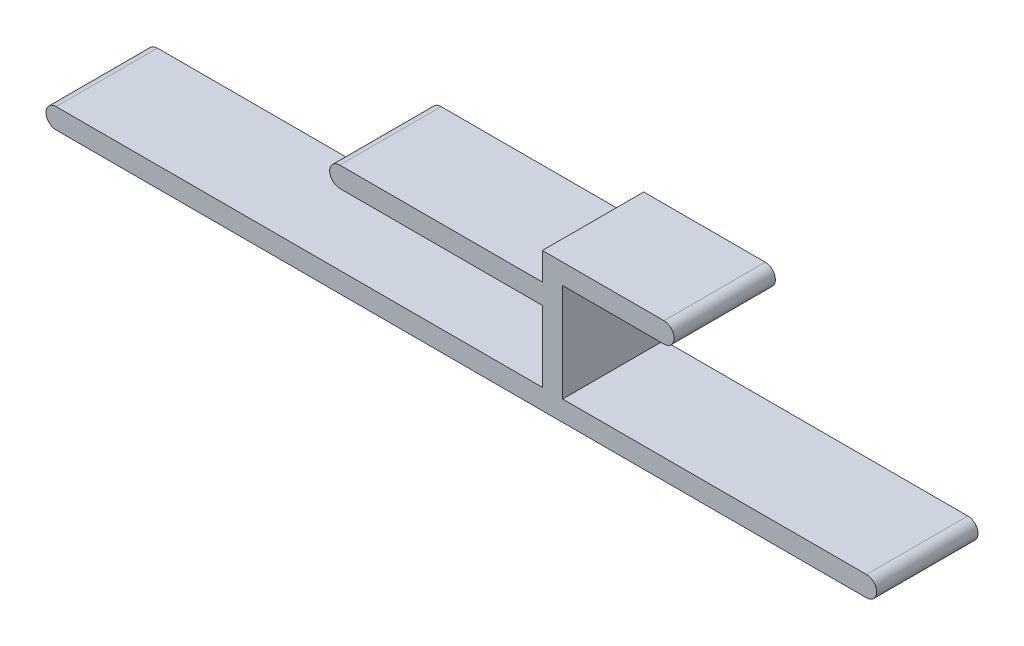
SolidWorks part; units mm, degrees
ref_plane "Front Plane" through (0, 0, 0) normal (0, 0, 1) x (1, 0, 0)
ref_plane "Top Plane" through (0, 0, 0) normal (0, 1, 0) x (1, 0, 0)
ref_plane "Right Plane" through (0, 0, 0) normal (1, 0, 0) x (0, 0, -1)
sketch "Sketch1" plane through (0, 0, 0) normal (0, 0, 1) x (0, -1, 0)
  line L0 (0, -50) -> (0, -2)
  line L1 (-7, -22) -> (-7, -2)
  line L2 (0, 0) -> (-9.7, 0)
  line L3 (-9.7, 0) -> (-9.7, 10)
  line L4 (-9, -22) -> (-9, -2)
  line L5 (0, -2) -> (-7, -2)
  line L6 (-11.7, -2) -> (-11.7, 10)
  line L7 (2, -50) -> (2, 30)
  line L8 (-9, -2) -> (-11.7, -2)
  line L9 (0, 0) -> (0, 30)
  line L10 (0, -2) -> (-11.7, -2) construction
  line L11 (-9, -22) -> (-9, -2) construction
  line L13 (0, -50) -> (0, 30) construction
  arc A0 (-7, -22) -> (-9, -22) centre (-8, -22) cw
  arc A3 (-9.7, 10) -> (-11.7, 10) centre (-10.7, 10) ccw
  arc A4 (0, -50) -> (2, -50) centre (1, -50) ccw
  arc A5 (0, 30) -> (2, 30) centre (1, 30) cw
  dimension "D1" = 30
  dimension "D2" = 20
  dimension "D3" = 7
  dimension "D4" = 9.7
  dimension "D5" = 50
  dimension "D6" = 10
  dimension "D7" = 2
  dimension "D8" = 2
extrude "Boss-Extrude1" add sketch "Sketch1" along normal blind 10
